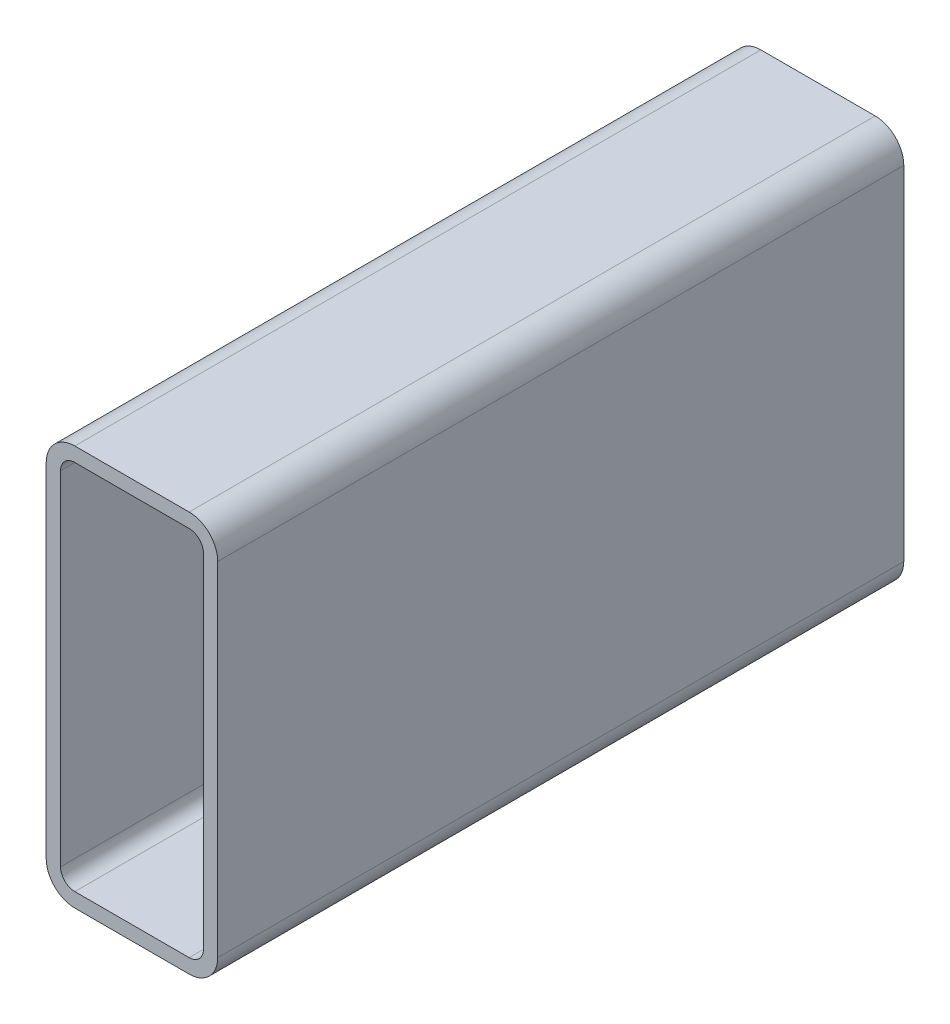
SolidWorks part; units mm, degrees
ref_plane "Front Plane" through (0, 0, 0) normal (0, 0, 1) x (1, 0, 0)
ref_plane "Top Plane" through (0, 0, 0) normal (0, 1, 0) x (1, 0, 0)
ref_plane "Right Plane" through (0, 0, 0) normal (1, 0, 0) x (0, 0, -1)
sketch "Sketch1" plane through (0, 0, 0) normal (0, 0, 1) x (1, 0, 0)
sketch_block_instance "HSS7x3x0.250-1"
sketch_block "HSS7x3x0.250"
extrude "Boss-Extrude1" add sketch "Sketch1" along normal blind 304.8
